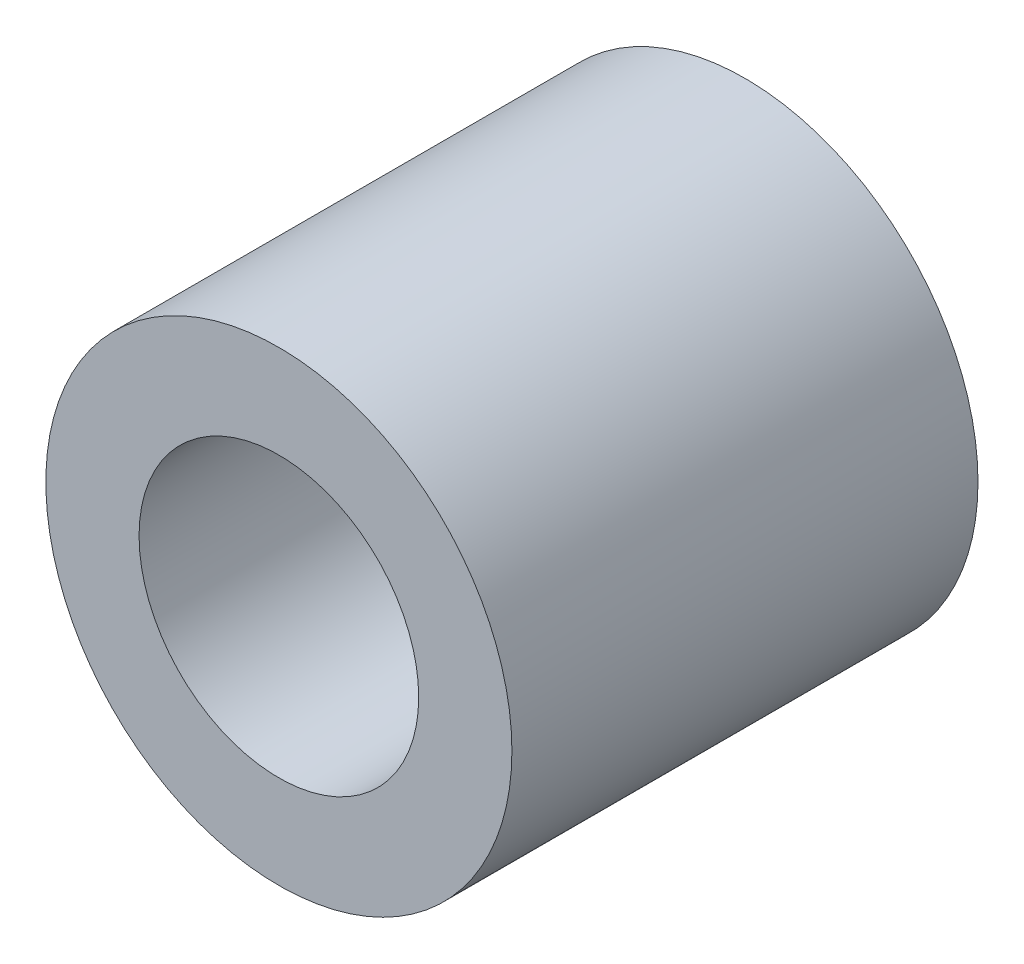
SolidWorks part; units mm, degrees
ref_plane "Front Plane" through (0, 0, 0) normal (0, 0, 1) x (1, 0, 0)
ref_plane "Top Plane" through (0, 0, 0) normal (0, 1, 0) x (1, 0, 0)
ref_plane "Right Plane" through (0, 0, 0) normal (1, 0, 0) x (0, 0, -1)
sketch "Sketch1" plane through (0, 0, 0) normal (0, 0, 1) x (1, 0, 0)
  circle A0 centre (0, 0) radius 3
  circle A1 centre (0, 0) radius 5
  dimension "D1" = 10
  dimension "D2" = 6
extrude "Boss-Extrude1" add sketch "Sketch1" along normal mid plane 10
